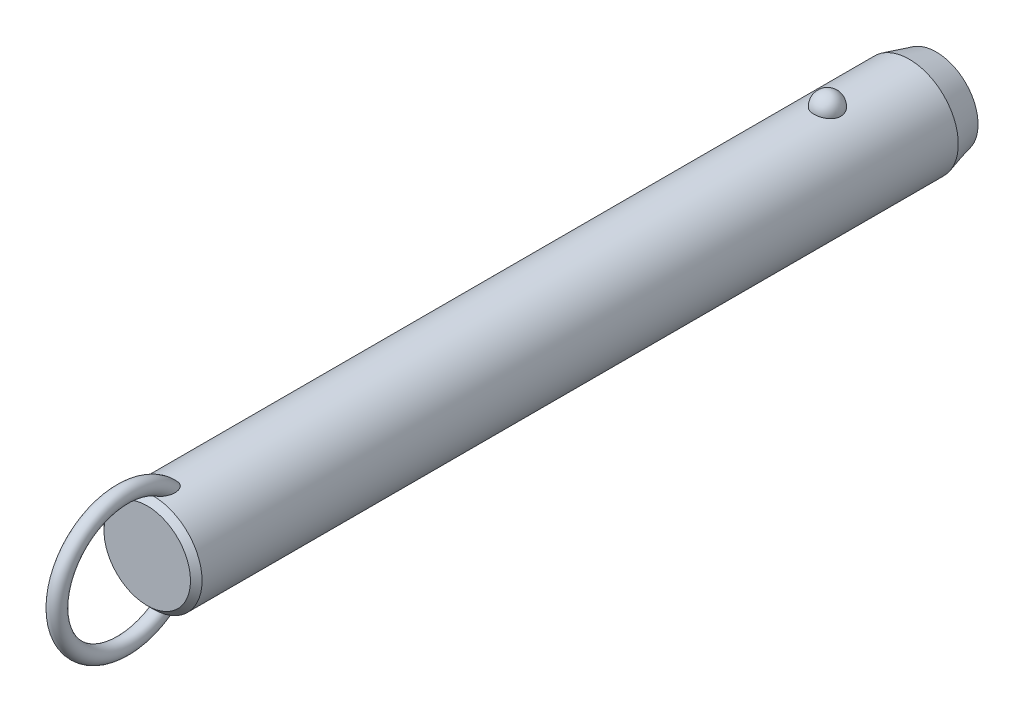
SolidWorks part; units mm, degrees
ref_plane "Front Plane" through (0, 0, 0) normal (0, 0, 1) x (1, 0, 0)
ref_plane "Top Plane" through (0, 0, 0) normal (0, 1, 0) x (1, 0, 0)
ref_plane "Right Plane" through (0, 0, 0) normal (1, 0, 0) x (0, 0, -1)
sketch "Sketch2" plane through (0, 0, 0) normal (0, 0, 1) x (1, 0, 0)
  circle A0 centre (0, 0) radius 12.7
  point P3 (0, 12.7)
  dimension "D1" = 25.4
extrude "Boss-Extrude1" add sketch "Sketch2" along normal blind 160
sketch "Sketch3" plane through (0, 0, 0) normal (0, 0, -1) x (-1, 0, 0)
  circle A0 centre (0, 0) radius 12.7
  dimension "D1" = 25.4
extrude "Boss-Extrude2" add sketch "Sketch3" along normal blind 31.7
chamfer "Chamfer1" distance 7 angle 15 1 edges at (-12.7, 0, -31.7)
sketch "Sketch12" plane through (0, 0, 0) normal (1, 0, 0) x (0, 0, -1)
  line L0 (-160, 12.7) -> (-160, -12.7) construction
  point P0 (-160, 0)
sketch "Sketch13" plane through (0, 0, 0) normal (1, 0, 0) x (0, 0, -1)
  circle A0 centre (-179.05, 0) radius 19.05
  point P2 (-160, 0)
  dimension "D1" = 38.1
sketch "Sketch14" plane through (0, 0, 0) normal (0, 1, 0) x (1, 0, 0)
  circle A0 centre (0, -162) radius 2
  point P2 (0, -160)
  dimension "D1" = 4
sweep "Sweep1" add profiles "Sketch14" path "Sketch13"
sketch "Sketch15" plane through (0, 0, 160) normal (0, 0, 1) x (1, 0, 0)
  circle A0 centre (0, 0) radius 12.7
  dimension "D1" = 25.4
extrude "Boss-Extrude3" add sketch "Sketch15" along normal blind 12.7
chamfer "Chamfer2" distance 1.5 angle 45 1 edges at (12.7, 0, 172.7)
sketch "Sketch18" plane through (0, 0, 0) normal (1, 0, 0) x (0, 0, -1)
  line L0 (24.7, 12.7) -> (-164.851, 12.7) construction
  line L1 (3.5, 16.2) -> (3.5, 9.2)
  line L2 (-164.851, -12.7) -> (24.7, -12.7) construction
  arc A0 (3.5, 16.2) -> (3.5, 9.2) centre (3.5, 12.7) ccw
  point P4 (0, 12.7)
  dimension "D1" = 28.9
revolve "Revolve1" add sketch "Sketch18" angle 360 about L1
